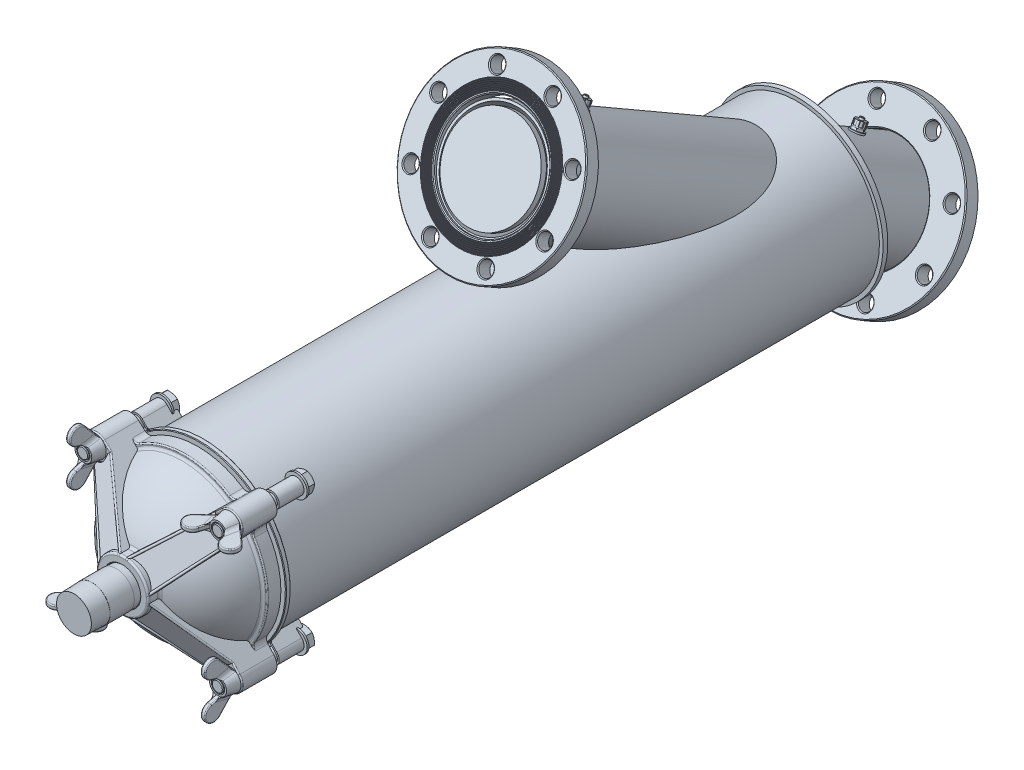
SolidWorks part; units mm, degrees
ref_plane "Front Plane" through (0, 0, 0) normal (0, 0, 1) x (1, 0, 0)
ref_plane "Top Plane" through (0, 0, 0) normal (0, 1, 0) x (1, 0, 0)
ref_plane "Right Plane" through (0, 0, 0) normal (1, 0, 0) x (0, 0, -1)
imported_body "DRB5-000200-1/DLB5-000124-1/DLB5-000124-1-1-solid1"
imported_body "DRB5-000200-1/DLB5-000124-1/DAB6-000662-1-solid1"
imported_body "DRB5-000200-1/DLB5-000124-1/DLB5-000119-2-1-solid1"
imported_body "DRB5-000200-1/DLB5-000124-1/DLB5-000119-3-1-solid1"
imported_body "DRB5-000200-1/DLB5-000124-1/Part2^DLB5-000124-1-solid1"
imported_body "DRB5-000200-1/DLB5-000124-1/740102-000093-1-solid1"
imported_body "DRB5-000200-1/DLB5-000124-1/740102-000093-2-solid1"
imported_body "DRB5-000200-1/DLB5-000124-1/DAB6-000663-1-solid1"
imported_body "DRB5-000200-1/DLB5-000124-1/DAB6-000662-2-solid1"
imported_body "DRB5-000200-1/DLB5-000124-1/DAB6-000662-3-solid1"
imported_body "DRB5-000200-1/DLB5-000124-1/DAB6-000662-4-solid1"
imported_body "DAB6-000679-1-solid1"
imported_body "DAB2-000591-1-solid1"
imported_body "DAB2-000591-2-solid1"
imported_body "780101-000937-1-solid1"
imported_body "DKB2-001305-1/DMA5-000547-1-solid1"
imported_body "DKB2-001305-2/DMA5-000547-1-solid1"
imported_body "DKB2-001305-2/770104-000067-1-solid1"
imported_body "760101-000297-1-solid1"
imported_body "760103-000070-1-solid1"
imported_body "760102-000076-1-solid1"
imported_body "760102-000076-2-solid1"
imported_body "760102-000076-3-solid1"
imported_body "760102-000076-4-solid1"
imported_body "760103-000070-2-solid1"
imported_body "760103-000070-3-solid1"
imported_body "760103-000070-4-solid1"
imported_body "760101-000297-2-solid1"
imported_body "760101-000297-3-solid1"
imported_body "760101-000297-4-solid1"
sketch "Sketch1" plane through (0, 293.0471, 507.5725) normal (0, 0.5, 0.866) x (1, 0, 0)
  circle A0 centre (0, 0) radius 75
extrude "Boss-Extrude2" add sketch "Sketch1" against normal blind 10
sketch "Sketch2" plane through (0, -81.9529, -141.9465) normal (0, -0.5, -0.866) x (-1, 0, 0)
  circle A0 centre (0, 0) radius 77.1626
extrude "Boss-Extrude3" add sketch "Sketch2" against normal blind 10 separate body
sketch "Sketch3" plane through (0, 0, 1197.7) normal (0, 0, 1) x (1, 0, 0)
  circle A0 centre (0, 0) radius 26.35
extrude "Boss-Extrude4" add sketch "Sketch3" against normal blind 10
